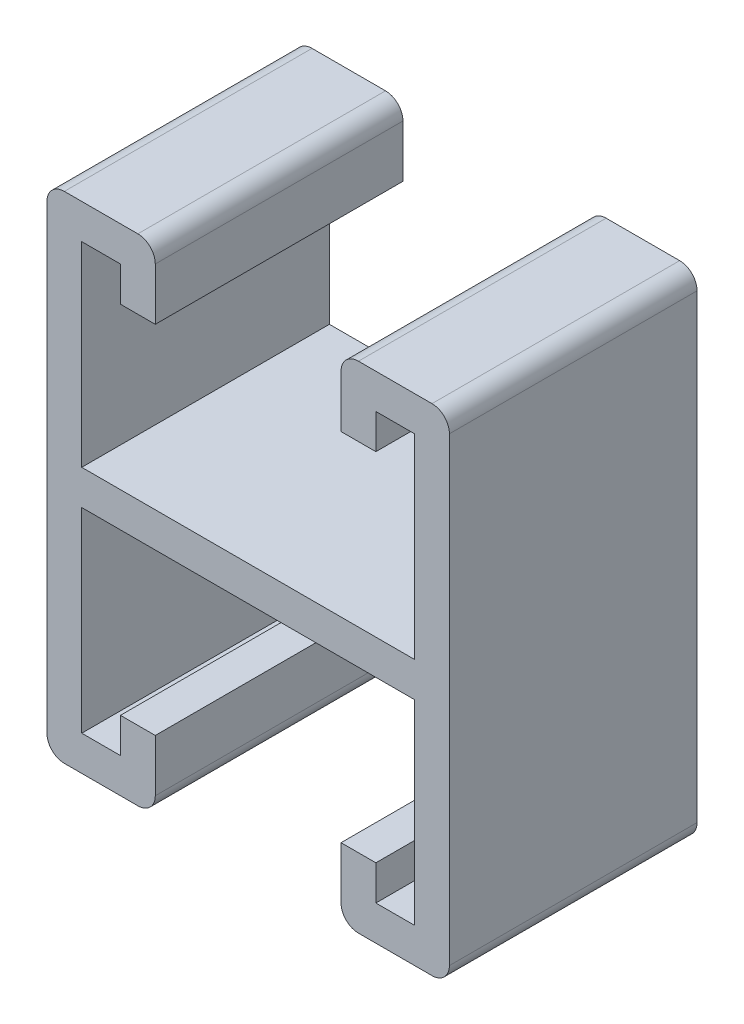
SolidWorks part; units mm, degrees
ref_plane "Plane1" through (0, 0, 0) normal (0, 0, 1) x (1, 0, 0)
ref_plane "Plane2" through (0, 0, 0) normal (0, 1, 0) x (1, 0, 0)
ref_plane "Plane3" through (0, 0, 0) normal (1, 0, 0) x (0, 0, -1)
sketch "Sketch1" plane through (0, 0, 0) normal (0, 0, 1) x (1, 0, 0)
  line L0 (-11.3109, 25.4) -> (-18.8516, 25.4)
  line L1 (-20.6375, 23.6141) -> (-20.6375, -23.6141)
  line L2 (25.727, 0) -> (-25.0678, 0) construction
  line L3 (20.6375, -23.6141) -> (20.6375, 23.6141)
  line L4 (18.8516, 25.4) -> (11.3109, 25.4)
  line L5 (9.525, 23.6141) -> (9.525, 18.2562)
  line L6 (-9.525, 23.6141) -> (-9.525, 18.2562)
  line L7 (-13.0969, 21.8281) -> (-13.0969, 18.2562)
  line L8 (-13.0969, 21.8281) -> (-17.0656, 21.8281)
  line L9 (-17.0656, 21.8281) -> (-17.0656, 1.7859)
  line L10 (-17.0656, 1.7859) -> (17.0656, 1.7859)
  line L11 (17.0656, 1.7859) -> (17.0656, 21.8281)
  line L12 (17.0656, 21.8281) -> (13.0969, 21.8281)
  line L13 (13.0969, 21.8281) -> (13.0969, 18.2562)
  line L14 (-13.0969, 18.2562) -> (-9.525, 18.2562)
  line L15 (9.525, 18.2562) -> (13.0969, 18.2562)
  line L16 (-11.3109, -25.4) -> (-18.8516, -25.4)
  line L17 (-13.0969, -21.8281) -> (-17.0656, -21.8281)
  line L18 (-13.0969, -21.8281) -> (-13.0969, -18.2562)
  line L19 (-9.525, -23.6141) -> (-9.525, -18.2562)
  line L20 (-13.0969, -18.2562) -> (-9.525, -18.2562)
  line L21 (18.8516, -25.4) -> (11.3109, -25.4)
  line L22 (9.525, -23.6141) -> (9.525, -18.2562)
  line L23 (9.525, -18.2562) -> (13.0969, -18.2562)
  line L24 (13.0969, -21.8281) -> (13.0969, -18.2562)
  line L25 (17.0656, -21.8281) -> (13.0969, -21.8281)
  line L26 (17.0656, -1.7859) -> (17.0656, -21.8281)
  line L27 (-17.0656, -21.8281) -> (-17.0656, -1.7859)
  line L28 (-17.0656, -1.7859) -> (17.0656, -1.7859)
  arc A0 (-11.3109, 25.4) -> (-9.525, 23.6141) centre (-11.3109, 23.6141) cw
  arc A1 (-20.6375, 23.6141) -> (-18.8516, 25.4) centre (-18.8516, 23.6141) cw
  arc A2 (-11.3109, -25.4) -> (-9.525, -23.6141) centre (-11.3109, -23.6141) ccw
  arc A3 (-20.6375, -23.6141) -> (-18.8516, -25.4) centre (-18.8516, -23.6141) ccw
  arc A4 (18.8516, 25.4) -> (20.6375, 23.6141) centre (18.8516, 23.6141) cw
  arc A5 (9.525, 23.6141) -> (11.3109, 25.4) centre (11.3109, 23.6141) cw
  arc A6 (18.8516, -25.4) -> (20.6375, -23.6141) centre (18.8516, -23.6141) ccw
  arc A7 (9.525, -23.6141) -> (11.3109, -25.4) centre (11.3109, -23.6141) ccw
  dimension "D2" = 1.7859
  dimension "D3" = 20.6375
  dimension "D4" = 25.4
  dimension "Width" = 41.275
  dimension "Height" = 50.8
  dimension "edge" = 11.1125
  dimension "D8" = 19.05
  dimension "ToeHt" = 7.1437
  dimension "D1" = 3.5719
  dimension "gauge" = 3.5719
extrude "Base-Extrude" add sketch "Sketch1" along normal mid plane 25.4
equation "\"D3@Sketch1\" = \"Width@Sketch1\" / 2"
equation "\"D2@Sketch1\" = \"gauge@Sketch1\" / 2"
equation "\"D8@Sketch1\" = \"Width@Sketch1\" - 2 * \"edge@Sketch1\""
equation "\"gauge@Sketch1\" = \"ToeHt@Sketch1\" / 2"
equation "\"D4@Sketch1\" = \"Height@Sketch1\" / 2"
